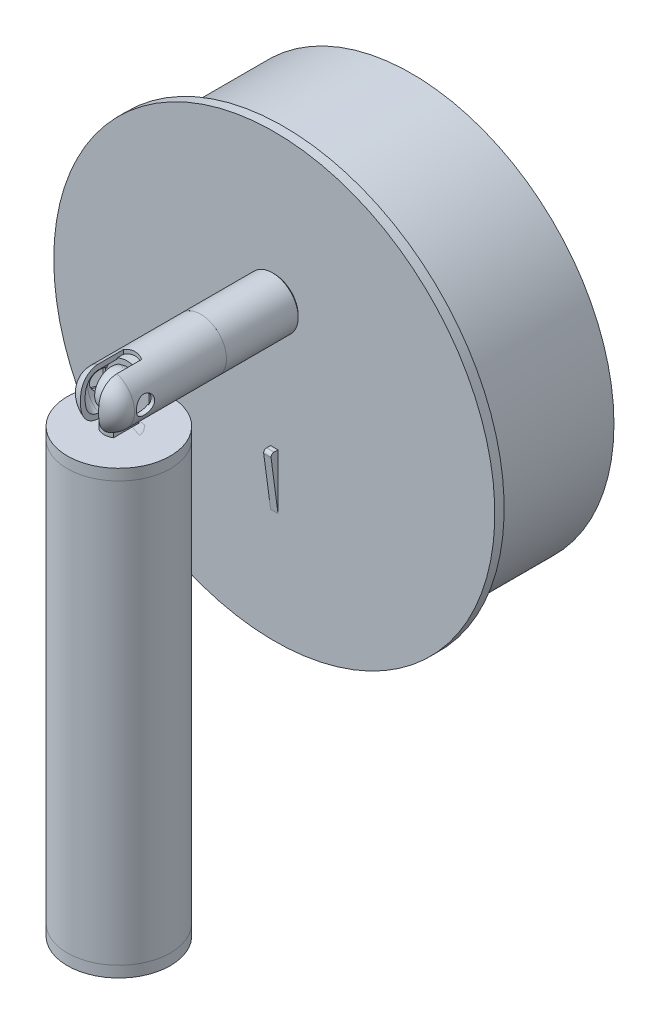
SolidWorks part; units mm, degrees
ref_plane "Alzado" through (0, 0, 0) normal (0, 0, 1) x (1, 0, 0)
ref_plane "Planta" through (0, 0, 0) normal (0, 1, 0) x (1, 0, 0)
ref_plane "Vista lateral" through (0, 0, 0) normal (1, 0, 0) x (0, 0, -1)
imported_body "ESTRUCTURA-1-solid2"
imported_body "Rotula1-1-solid1"
imported_body "Rotula1-1-solid2"
imported_body "Rotula2-1-solid1"
imported_body "rotula3-1-solid1"
imported_body "rotula3-1-solid2"
imported_body "cabezal-1-solid1"
imported_body "cabezal-1-solid2"
imported_body "cabezal-1-solid3"
imported_body "cabezal-1-solid4"
sketch "Croquis1" plane through (0, 0, 26) normal (0, 0, -1) x (-1, 0, 0)
  circle A0 centre (0, 0) radius 59.944
  dimension "D1" = 119.888
extrude "Saliente-Extruir1" add sketch "Croquis1" along normal blind 2.54
sketch "Croquis2" plane through (0, 0, 23.46) normal (0, 0, -1) x (-1, 0, 0)
  circle A0 centre (0, 0) radius 54.991
  dimension "D1" = 109.982
extrude "Saliente-Extruir2" add sketch "Croquis2" along normal blind 34.798
